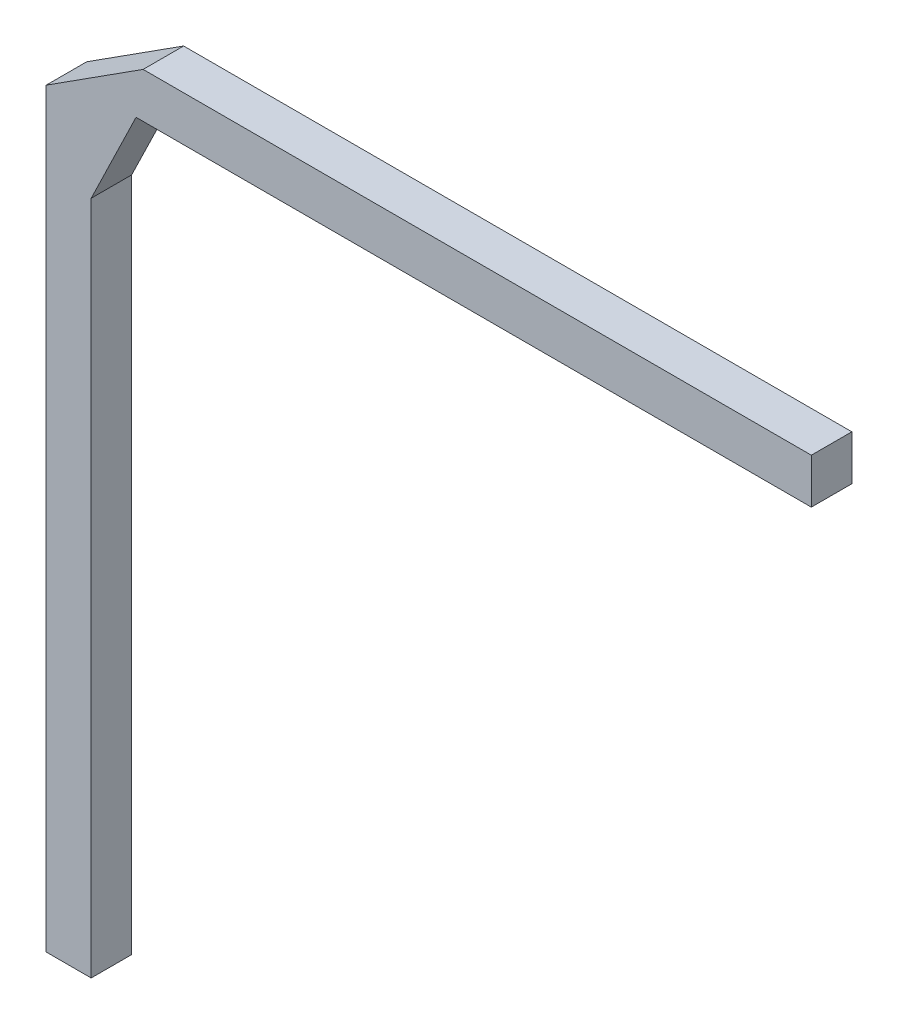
SolidWorks part; units mm, degrees
ref_plane "Front Plane" through (0, 0, 0) normal (0, 0, 1) x (1, 0, 0)
ref_plane "Top Plane" through (0, 0, 0) normal (0, 1, 0) x (1, 0, 0)
ref_plane "Right Plane" through (0, 0, 0) normal (1, 0, 0) x (0, 0, -1)
sketch "Sketch1" plane through (0, 0, 0) normal (0, 0, 1) x (1, 0, 0)
  line L0 (7.9538, -1.8) -> (8.9538, -1.8)
  line L1 (8.9538, -1.8) -> (8.9538, 13.2)
  line L2 (8.9538, 13.2) -> (9.9508, 15.2559)
  line L3 (9.9508, 15.2559) -> (24.9508, 15.2559)
  line L4 (24.9508, 15.2559) -> (24.9508, 16.2559)
  line L5 (24.9508, 16.2559) -> (10.1079, 16.2559)
  line L6 (10.1079, 16.2559) -> (7.9538, 14.8755)
  line L7 (7.9538, 14.8755) -> (7.9538, -1.8)
  dimension "D1" = 1
  dimension "D2" = 1
  dimension "D3" = 15
  dimension "D5" = 15
  dimension "D6" = 2.2849
  dimension "D7" = 154.13
  dimension "D8" = 2.5584
  dimension "D9" = 122.654
  dimension "D10" = 14.8429
  dimension "D11" = 16.6755
extrude "Boss-Extrude1" add sketch "Sketch1" along normal blind 0.9
